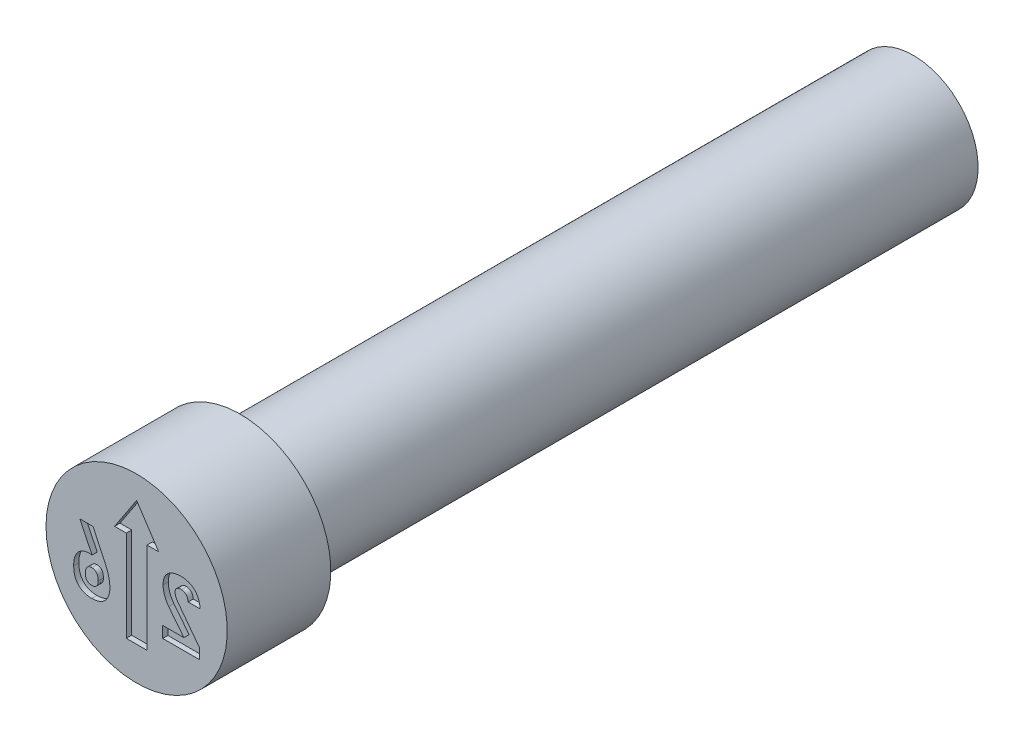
SolidWorks part; units mm, degrees
ref_plane "Front Plane" through (0, 0, 0) normal (0, 0, 1) x (1, 0, 0)
ref_plane "Top Plane" through (0, 0, 0) normal (0, 1, 0) x (1, 0, 0)
ref_plane "Right Plane" through (0, 0, 0) normal (1, 0, 0) x (0, 0, -1)
imported_body "Imported1"
sketch "Sketch1" plane through (0, 0, -0.2845) normal (0, 0, 1) x (1, 0, 0)
  line L7 (0.4256, 0.6604) -> (0, 1.3065)
  line L8 (0, 1.3065) -> (-0.4256, 0.6604)
  line L9 (-0.4256, 0.6604) -> (-0.2, 0.6604)
  line L10 (-0.2, 0.6604) -> (-0.2, -1.1)
  line L11 (-0.2, -1.1) -> (0.2, -1.1)
  line L12 (0.2, -1.1) -> (0.2, 0.6604)
  line L13 (0.2, 0.6604) -> (0.4256, 0.6604)
  line L14 (0.4256, 0.6604) -> (0, 1.3065)
  line L15 (0, 1.3065) -> (-0.4256, 0.6604)
  line L16 (-0.4256, 0.6604) -> (-0.2, 0.6604)
  line L17 (-0.2, 0.6604) -> (-0.2, -1.1)
  line L18 (-0.2, -1.1) -> (0.2, -1.1)
  line L19 (0.2, -1.1) -> (0.2, 0.6604)
  line L20 (0.2, 0.6604) -> (0.4256, 0.6604)
  dimension "D1" = 0
extrude "Boss-Extrude1" add sketch "Sketch1" along normal blind 0.18
sketch "Sketch2" plane through (0, 0, 0) normal (0, 0, 1) x (1, 0, 0)
  text T0 "2   6" font "Bahnschrift" height 1.2
  dimension "D1" = 0.75
  dimension "D2" = 1.3
extrude "Cut-Extrude1" cut sketch "Sketch2" against normal blind 0.1
